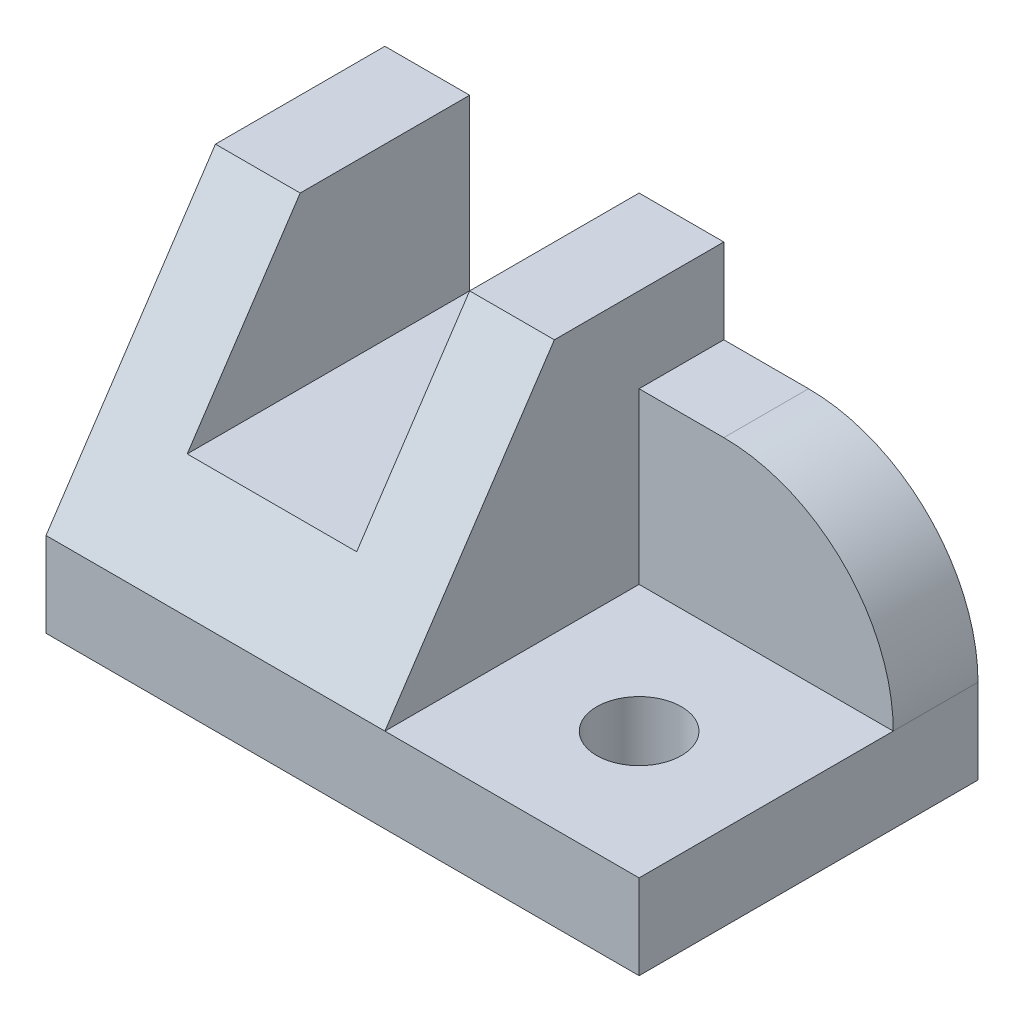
SolidWorks part; units mm, degrees
ref_plane "Front Plane" through (0, 0, 0) normal (0, 0, 1) x (1, 0, 0)
ref_plane "Top Plane" through (0, 0, 0) normal (0, 1, 0) x (1, 0, 0)
ref_plane "Right Plane" through (0, 0, 0) normal (1, 0, 0) x (0, 0, -1)
sketch "Sketch1" plane through (0, 0, 0) normal (0, 1, 0) x (1, 0, 0)
  line L1 (0, 0) -> (70, 0)
  line L2 (0, 0) -> (0, 40)
  line L3 (0, 40) -> (70, 40)
  line L4 (70, 0) -> (70, 40)
  dimension "D1" = 70
  dimension "D2" = 40
extrude "Extrude1" add sketch "Sketch1" along normal blind 10
sketch "Sketch2" plane through (0, 0, 0) normal (1, 0, 0) x (0, 0, -1)
  line L0 (40, 10) -> (40, 40)
  line L1 (40, 40) -> (20, 40)
  line L2 (20, 40) -> (0, 10)
  line L3 (0, 10) -> (40, 10)
  line L4 (40, 0) -> (0, 0) construction
  dimension "D1" = 20
  dimension "D2" = 40
extrude "Extrude2" add sketch "Sketch2" along normal blind 40
sketch "Sketch3" plane through (0, 0, -40) normal (0, 0, -1) x (-1, 0, 0)
  line L0 (-40, 40) -> (0, 40) construction
  line L1 (-30, 40) -> (-10, 40)
  line L2 (-30, 40) -> (-30, 20)
  line L3 (-30, 20) -> (-10, 20)
  line L4 (-10, 40) -> (-10, 20)
  line L5 (0, 40) -> (0, 0) construction
  dimension "D1" = 20
  dimension "D2" = 20
  dimension "D3" = 10
extrude "Extrude3" cut sketch "Sketch3" against normal through all
sketch "Sketch4" plane through (0, 10, 0) normal (0, 1, 0) x (1, 0, 0)
  line L0 (40, 0) -> (40, 40) construction
  line L1 (70, 40) -> (40, 40)
  line L2 (70, 40) -> (70, 30)
  line L3 (70, 30) -> (40, 30)
  line L4 (40, 40) -> (40, 30)
  dimension "D1" = 10
extrude "Extrude4" add sketch "Sketch4" along normal blind 20
sketch "Sketch5" plane through (0, 10, 0) normal (0, 1, 0) x (1, 0, 0)
  line L0 (70, 0) -> (70, 30) construction
  line L1 (40, 0) -> (70, 0) construction
  circle A0 centre (55, 15) radius 5
  dimension "D1" = 10
  dimension "D2" = 15
  dimension "D3" = 15
extrude "Extrude5" cut sketch "Sketch5" against normal through all
fillet "Fillet1" radius 20 1 edges at (70, 30, -35)
